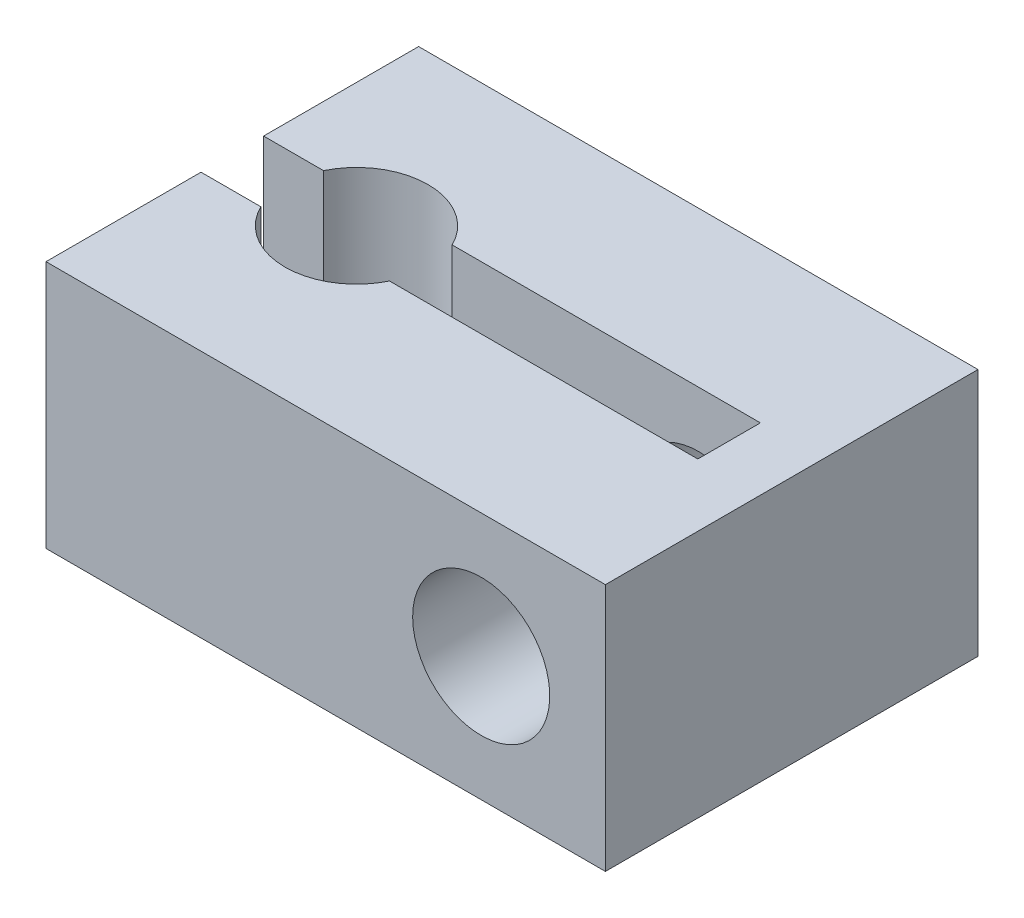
SolidWorks part; units mm, degrees
ref_plane "Front/Back" through (0, 0, 0) normal (0, 0, 1) x (1, 0, 0)
ref_plane "Top/Bottom" through (0, 0, 0) normal (0, 1, 0) x (1, 0, 0)
ref_plane "Right/Left" through (0, 0, 0) normal (1, 0, 0) x (0, 0, -1)
sketch "Sketch1" plane through (0, 0, 0) normal (0, 1, 0) x (1, 0, 0)
  line L0 (0, 0) -> (7.1501, 0) construction
  line L1 (-7.1501, 4.7625) -> (7.1501, 4.7625)
  line L2 (-7.1501, 4.7625) -> (-7.1501, -4.7625)
  line L3 (-7.1501, -4.7625) -> (7.1501, -4.7625)
  line L4 (7.1501, 4.7625) -> (7.1501, -4.7625)
  line L5 (0, 0) -> (0, 4.7625) construction
  dimension "D1" = 14.3002
  dimension "D2" = 9.525
extrude "Extrude1" add sketch "Sketch1" along normal mid plane 6.35
sketch "Sketch2" plane through (0, 3.175, 0) normal (0, 1, 0) x (-1, 0, 0)
  line L0 (0, 0) -> (5.484, 0) construction
  line L1 (0, 0) -> (0, 6.0729) construction
  line L2 (7.1501, -4.7625) -> (7.1501, 4.7625) construction
  line L3 (7.1501, -0.8001) -> (5.6196, -0.8001)
  line L4 (7.1501, -0.8001) -> (7.1501, 0.8001)
  line L5 (7.1501, 0.8001) -> (5.6196, 0.8001)
  line L6 (-5.5499, -0.8001) -> (-5.5499, 0.8001)
  line L7 (-7.1501, 4.7625) -> (-7.1501, -4.7625) construction
  line L8 (2.3306, -0.8001) -> (-5.5499, -0.8001)
  line L9 (2.3306, 0.8001) -> (-5.5499, 0.8001)
  arc A0 (2.3306, -0.8001) -> (5.6196, -0.8001) centre (3.9751, 0) ccw
  arc A1 (5.6196, 0.8001) -> (2.3306, 0.8001) centre (3.9751, 0) ccw
  dimension "D1" = 3.6576
  dimension "D4" = 3.175
  dimension "D2" = 1.6002
  dimension "D3" = 1.6002
extrude "Cut-Extrude1" cut sketch "Sketch2" against normal through all
sketch "Sketch3" plane through (0, 0, -4.7625) normal (0, 0, -1) x (-1, 0, 0)
  line L0 (0, 0) -> (7.7268, 0) construction
  line L1 (0, 0) -> (0, 4.0758) construction
  line L2 (-7.1501, 3.175) -> (-7.1501, -3.175) construction
  circle A0 centre (-3.9751, 0) radius 1.7526
  dimension "D1" = 3.5052
  dimension "D2" = 3.175
extrude "Cut-Extrude2" cut sketch "Sketch3" against normal through all
